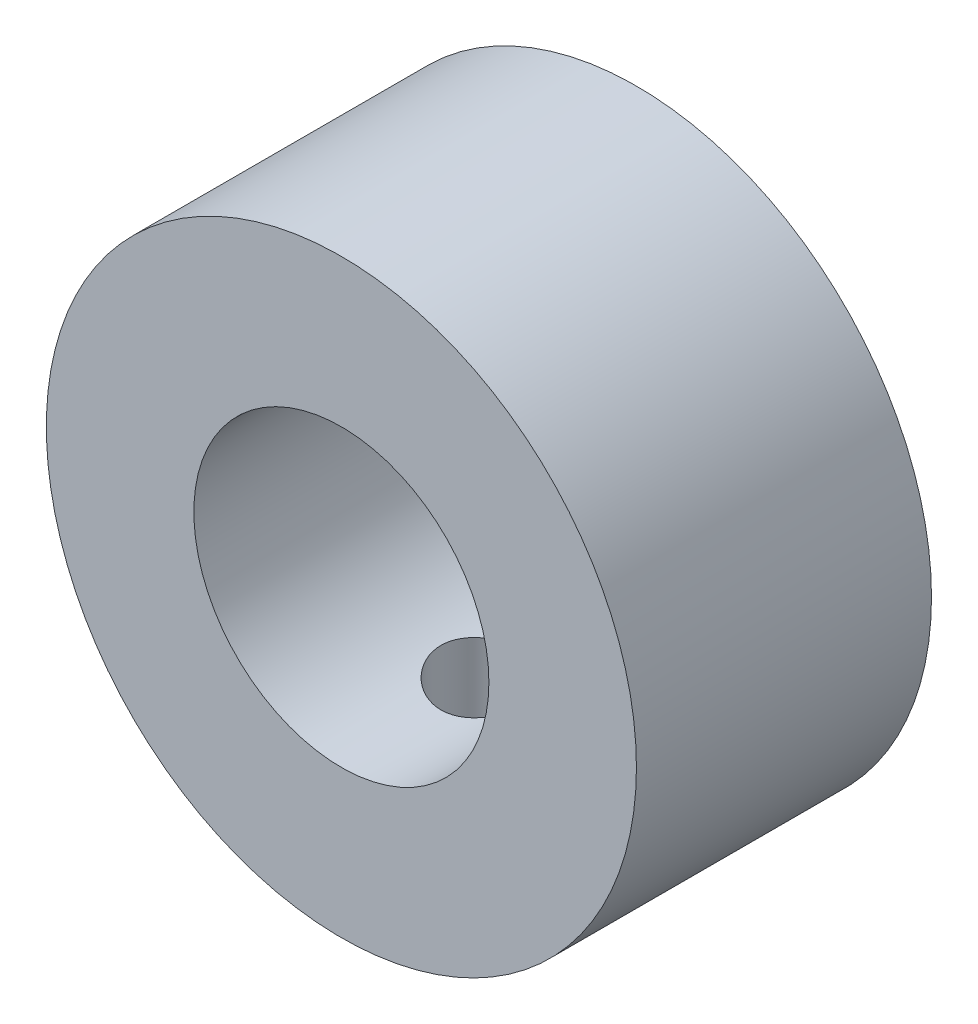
SolidWorks part; units mm, degrees
ref_plane "Face" through (0, 0, 0) normal (0, 0, 1) x (1, 0, 0)
ref_plane "Dessus" through (0, 0, 0) normal (0, 1, 0) x (1, 0, 0)
ref_plane "Droite" through (0, 0, 0) normal (1, 0, 0) x (0, 0, -1)
sketch "Esquisse1" plane through (0, 0, 0) normal (0, 0, 1) x (1, 0, 0)
  circle A0 centre (0, 0) radius 20
  circle A1 centre (0, 0) radius 10
  dimension "D1" = 40
  dimension "D2" = 20
extrude "Base-Extrusion" add sketch "Esquisse1" along normal blind 20
sketch "Esquisse2" plane through (0, 0, 0) normal (0, 1, 0) x (1, 0, 0)
  line L0 (0, -20) -> (0, 0) construction
  line L1 (20, 0) -> (-20, 0) construction
  circle A0 centre (0, -10) radius 3.25
  dimension "D1" = 6.5
  dimension "D2" = 10
extrude "Enlèv. mat.-Extru.3" cut sketch "Esquisse2" against normal blind 25
